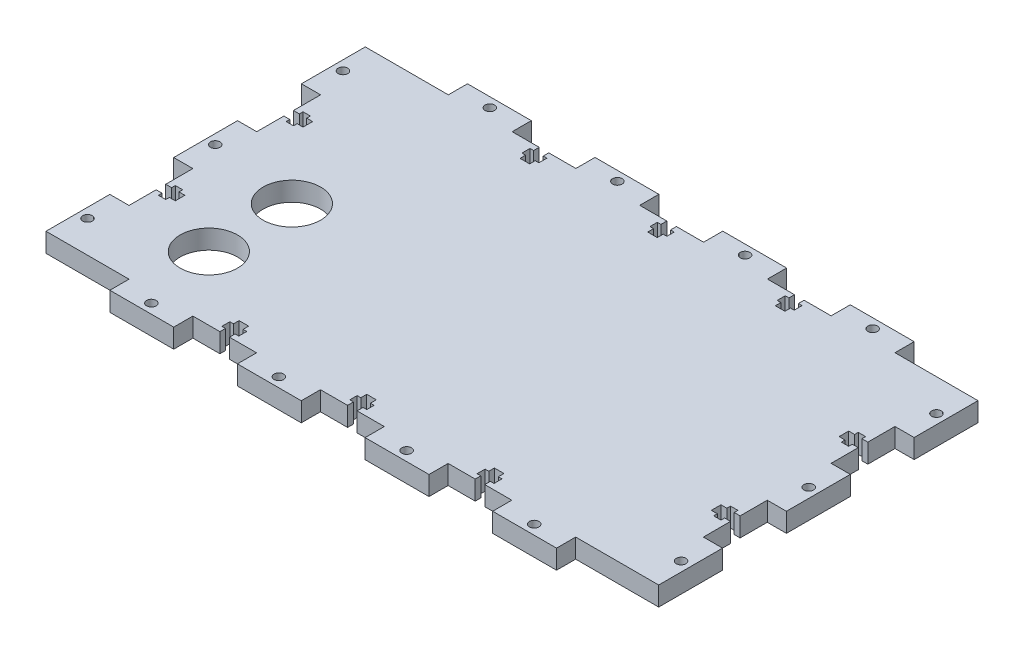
SolidWorks part; units mm, degrees
ref_plane "Front Plane" through (0, 0, 0) normal (0, 0, 1) x (1, 0, 0)
ref_plane "Top Plane" through (0, 0, 0) normal (0, 1, 0) x (1, 0, 0)
ref_plane "Right Plane" through (0, 0, 0) normal (1, 0, 0) x (0, 0, -1)
sketch "Sketch1" plane through (0, 0, 0) normal (0, 1, 0) x (1, 0, 0)
  line L5 (0, 60) -> (6, 60)
  line L7 (6, 80) -> (0, 80)
  line L8 (0, 80) -> (0, 100)
  line L36 (26, 100) -> (26, 106)
  line L37 (26, 106) -> (46, 106)
  line L38 (46, 106) -> (46, 100)
  line L40 (65.944, 100) -> (65.944, 106)
  line L41 (65.944, 106) -> (85.944, 106)
  line L42 (85.944, 106) -> (85.944, 100)
  line L52 (46, 100) -> (54.472, 100)
  line L53 (54.472, 100) -> (54.472, 98.25)
  line L54 (54.472, 98.25) -> (53.322, 98.25)
  line L55 (53.322, 98.25) -> (53.322, 95.75)
  line L56 (53.322, 95.75) -> (54.472, 95.75)
  line L57 (54.472, 95.75) -> (54.472, 94)
  line L58 (54.472, 94) -> (57.472, 94)
  line L59 (57.472, 94) -> (57.472, 95.75)
  line L60 (57.472, 95.75) -> (58.622, 95.75)
  line L61 (58.622, 95.75) -> (58.622, 98.25)
  line L62 (58.622, 98.25) -> (57.472, 98.25)
  line L63 (57.472, 98.25) -> (57.472, 100)
  line L64 (57.472, 100) -> (65.944, 100)
  line L65 (85.944, 100) -> (94.444, 100)
  line L91 (6, 80) -> (6, 71.5)
  line L92 (6, 71.5) -> (7.85, 71.5)
  line L93 (7.85, 71.5) -> (7.85, 72.65)
  line L94 (7.85, 72.65) -> (10.15, 72.65)
  line L95 (10.15, 72.65) -> (10.15, 71.5)
  line L96 (10.15, 71.5) -> (12, 71.5)
  line L97 (12, 71.5) -> (12, 68.5)
  line L98 (12, 68.5) -> (10.15, 68.5)
  line L99 (10.15, 68.5) -> (10.15, 67.35)
  line L100 (10.15, 67.35) -> (7.85, 67.35)
  line L101 (7.85, 67.35) -> (7.85, 68.5)
  line L102 (7.85, 68.5) -> (6, 68.5)
  line L103 (6, 68.5) -> (6, 60)
  line L118 (0, 50) -> (189.9988, 50) construction
  line L119 (94.444, 100) -> (94.444, 98.15)
  line L120 (94.444, 98.15) -> (93.294, 98.15)
  line L121 (93.294, 98.15) -> (93.294, 95.85)
  line L122 (94.444, 95.85) -> (93.294, 95.85)
  line L123 (94.444, 95.85) -> (94.444, 94)
  line L124 (94.444, 94) -> (97.444, 94)
  line L125 (95.944, 106) -> (95.944, -6) construction
  line L126 (0, 60) -> (0, 40)
  line L127 (94.444, 6) -> (97.444, 6)
  line L128 (94.444, 4.15) -> (94.444, 6)
  line L129 (94.444, 4.15) -> (93.294, 4.15)
  line L130 (93.294, 1.85) -> (93.294, 4.15)
  line L131 (94.444, 1.85) -> (93.294, 1.85)
  line L132 (94.444, 0) -> (94.444, 1.85)
  line L133 (6, 31.5) -> (6, 40)
  line L134 (7.85, 31.5) -> (6, 31.5)
  line L135 (7.85, 32.65) -> (7.85, 31.5)
  line L136 (10.15, 32.65) -> (7.85, 32.65)
  line L137 (10.15, 31.5) -> (10.15, 32.65)
  line L138 (12, 31.5) -> (10.15, 31.5)
  line L139 (12, 28.5) -> (12, 31.5)
  line L140 (10.15, 28.5) -> (12, 28.5)
  line L141 (10.15, 27.35) -> (10.15, 28.5)
  line L142 (7.85, 27.35) -> (10.15, 27.35)
  line L143 (7.85, 28.5) -> (7.85, 27.35)
  line L144 (6, 28.5) -> (7.85, 28.5)
  line L145 (6, 20) -> (6, 28.5)
  line L146 (85.944, 0) -> (94.444, 0)
  line L147 (57.472, 0) -> (65.944, 0)
  line L148 (57.472, 1.75) -> (57.472, 0)
  line L149 (58.622, 1.75) -> (57.472, 1.75)
  line L150 (58.622, 4.25) -> (58.622, 1.75)
  line L151 (57.472, 4.25) -> (58.622, 4.25)
  line L152 (57.472, 6) -> (57.472, 4.25)
  line L153 (54.472, 6) -> (57.472, 6)
  line L154 (54.472, 4.25) -> (54.472, 6)
  line L155 (53.322, 4.25) -> (54.472, 4.25)
  line L156 (53.322, 1.75) -> (53.322, 4.25)
  line L157 (54.472, 1.75) -> (53.322, 1.75)
  line L158 (54.472, 0) -> (54.472, 1.75)
  line L159 (46, 0) -> (54.472, 0)
  line L160 (85.944, -6) -> (85.944, 0)
  line L161 (65.944, -6) -> (85.944, -6)
  line L162 (65.944, 0) -> (65.944, -6)
  line L163 (46, -6) -> (46, 0)
  line L164 (26, -6) -> (46, -6)
  line L165 (26, 0) -> (26, -6)
  line L167 (0, 20) -> (0, 0)
  line L168 (6, 20) -> (0, 20)
  line L169 (0, 40) -> (6, 40)
  line L170 (97.444, 4.15) -> (97.444, 6)
  line L171 (97.444, 4.15) -> (98.594, 4.15)
  line L172 (98.594, 1.85) -> (98.594, 4.15)
  line L173 (97.444, 1.85) -> (98.594, 1.85)
  line L174 (97.444, 0) -> (97.444, 1.85)
  line L175 (105.944, 0) -> (97.444, 0)
  line L177 (185.8879, 80) -> (191.8879, 80)
  line L178 (191.8879, 80) -> (191.8879, 100)
  line L179 (191.8879, 60) -> (185.8879, 60)
  line L180 (191.8879, 60) -> (191.8879, 40)
  line L181 (191.8879, 40) -> (185.8879, 40)
  line L182 (185.8879, 20) -> (191.8879, 20)
  line L183 (191.8879, 20) -> (191.8879, 0)
  line L185 (165.8879, 0) -> (165.8879, -6)
  line L186 (165.8879, -6) -> (145.8879, -6)
  line L187 (145.8879, -6) -> (145.8879, 0)
  line L188 (125.944, 0) -> (125.944, -6)
  line L189 (125.944, -6) -> (105.944, -6)
  line L190 (105.944, -6) -> (105.944, 0)
  line L191 (145.8879, 0) -> (137.4159, 0)
  line L192 (137.4159, 0) -> (137.4159, 1.75)
  line L193 (137.4159, 1.75) -> (138.5659, 1.75)
  line L194 (138.5659, 1.75) -> (138.5659, 4.25)
  line L195 (138.5659, 4.25) -> (137.4159, 4.25)
  line L196 (137.4159, 4.25) -> (137.4159, 6)
  line L197 (137.4159, 6) -> (134.4159, 6)
  line L198 (134.4159, 6) -> (134.4159, 4.25)
  line L199 (134.4159, 4.25) -> (133.2659, 4.25)
  line L200 (133.2659, 4.25) -> (133.2659, 1.75)
  line L201 (133.2659, 1.75) -> (134.4159, 1.75)
  line L202 (134.4159, 1.75) -> (134.4159, 0)
  line L203 (134.4159, 0) -> (125.944, 0)
  line L204 (185.8879, 20) -> (185.8879, 28.5)
  line L205 (185.8879, 28.5) -> (184.0379, 28.5)
  line L206 (184.0379, 28.5) -> (184.0379, 27.35)
  line L207 (184.0379, 27.35) -> (181.7379, 27.35)
  line L208 (181.7379, 27.35) -> (181.7379, 28.5)
  line L209 (181.7379, 28.5) -> (179.8879, 28.5)
  line L210 (179.8879, 28.5) -> (179.8879, 31.5)
  line L211 (179.8879, 31.5) -> (181.7379, 31.5)
  line L212 (181.7379, 31.5) -> (181.7379, 32.65)
  line L213 (181.7379, 32.65) -> (184.0379, 32.65)
  line L214 (184.0379, 32.65) -> (184.0379, 31.5)
  line L215 (184.0379, 31.5) -> (185.8879, 31.5)
  line L216 (185.8879, 31.5) -> (185.8879, 40)
  line L217 (185.8879, 68.5) -> (185.8879, 60)
  line L218 (184.0379, 68.5) -> (185.8879, 68.5)
  line L219 (184.0379, 67.35) -> (184.0379, 68.5)
  line L220 (181.7379, 67.35) -> (184.0379, 67.35)
  line L221 (181.7379, 68.5) -> (181.7379, 67.35)
  line L222 (179.8879, 68.5) -> (181.7379, 68.5)
  line L223 (179.8879, 71.5) -> (179.8879, 68.5)
  line L224 (181.7379, 71.5) -> (179.8879, 71.5)
  line L225 (181.7379, 72.65) -> (181.7379, 71.5)
  line L226 (184.0379, 72.65) -> (181.7379, 72.65)
  line L227 (184.0379, 71.5) -> (184.0379, 72.65)
  line L228 (185.8879, 71.5) -> (184.0379, 71.5)
  line L229 (185.8879, 80) -> (185.8879, 71.5)
  line L230 (134.4159, 100) -> (125.944, 100)
  line L231 (134.4159, 98.25) -> (134.4159, 100)
  line L232 (133.2659, 98.25) -> (134.4159, 98.25)
  line L233 (133.2659, 95.75) -> (133.2659, 98.25)
  line L234 (134.4159, 95.75) -> (133.2659, 95.75)
  line L235 (134.4159, 94) -> (134.4159, 95.75)
  line L236 (137.4159, 94) -> (134.4159, 94)
  line L237 (137.4159, 95.75) -> (137.4159, 94)
  line L238 (138.5659, 95.75) -> (137.4159, 95.75)
  line L239 (138.5659, 98.25) -> (138.5659, 95.75)
  line L240 (137.4159, 98.25) -> (138.5659, 98.25)
  line L241 (137.4159, 100) -> (137.4159, 98.25)
  line L242 (145.8879, 100) -> (137.4159, 100)
  line L243 (105.944, 106) -> (105.944, 100)
  line L244 (125.944, 106) -> (105.944, 106)
  line L245 (125.944, 100) -> (125.944, 106)
  line L246 (145.8879, 106) -> (145.8879, 100)
  line L247 (165.8879, 106) -> (145.8879, 106)
  line L248 (165.8879, 100) -> (165.8879, 106)
  line L249 (105.944, 100) -> (97.444, 100)
  line L250 (97.444, 95.85) -> (97.444, 94)
  line L251 (97.444, 95.85) -> (98.594, 95.85)
  line L252 (98.594, 98.15) -> (98.594, 95.85)
  line L253 (97.444, 98.15) -> (98.594, 98.15)
  line L254 (97.444, 100) -> (97.444, 98.15)
  line L255 (0, 100) -> (26, 100)
  line L256 (0, 0) -> (26, 0)
  line L257 (165.8879, 0) -> (191.8879, 0)
  line L258 (191.8879, 100) -> (165.8879, 100)
  circle A0 centre (3, 90) radius 1.5
  circle A1 centre (36, 103) radius 1.5
  circle A2 centre (75.944, 103) radius 1.5
  circle A5 centre (3, 50) radius 1.5
  circle A14 centre (3, 10) radius 1.5
  circle A15 centre (155.8879, -3) radius 1.5
  circle A16 centre (115.944, -3) radius 1.5
  circle A17 centre (115.944, 103) radius 1.5
  circle A18 centre (115.8879, 103) radius 1.5
  circle A19 centre (155.8319, 103) radius 1.5
  circle A20 centre (75.944, -3) radius 1.5
  circle A21 centre (36, -3) radius 1.5
  circle A22 centre (3, 10) radius 1.5
  circle A23 centre (155.8879, 103) radius 1.5
  circle A24 centre (188.8879, 90) radius 1.5
  circle A25 centre (188.8879, 50) radius 1.5
  circle A26 centre (188.8879, 10) radius 1.5
  point P101 (95.944, 6)
  point P206 (95.944, 94)
  dimension "D6" = 3
  dimension "D14" = 10
  dimension "D2" = 6
  dimension "D5" = 1.5
  dimension "D7" = 3
  dimension "D8" = 10
  dimension "D9" = 3
  dimension "D10" = 10
  dimension "D12" = 10
  dimension "D15" = 20
  dimension "D16" = 1.15
  dimension "D18" = 2.3
  dimension "D19" = 6
  dimension "D20" = 2.3
  dimension "D23" = 3
  dimension "D24" = 5.3
  dimension "D25" = 6
  dimension "D26" = 2.5
  dimension "D27" = 8.472
  dimension "D28" = 6
  dimension "D29" = 10
  dimension "D30" = 26
  dimension "D32" = 20
  dimension "D38" = 3
  dimension "D39" = 5.3
  dimension "D40" = 6
  dimension "D41" = 2.3
  dimension "D42" = 8.5
  dimension "D43" = 8.5
  dimension "D17" = 0
  dimension "D21" = 8.5
  dimension "D11" = 4
  dimension "D13" = 3
extrude "Boss-Extrude1" add sketch "Sketch1" along normal blind 6
sketch "Sketch2" plane through (0, 6, 0) normal (0, 1, 0) x (1, 0, 0)
  line L0 (26, -6) -> (46, -6) construction
  line L1 (0, 60) -> (0, 40) construction
  circle A0 centre (31, 46) radius 9
  circle A1 centre (31, 20) radius 9
  dimension "D1" = 18
  dimension "D2" = 26
  dimension "D3" = 25
  dimension "D4" = 26
  dimension "D5" = 31
extrude "Cut-Extrude1" cut sketch "Sketch2" against normal through all
